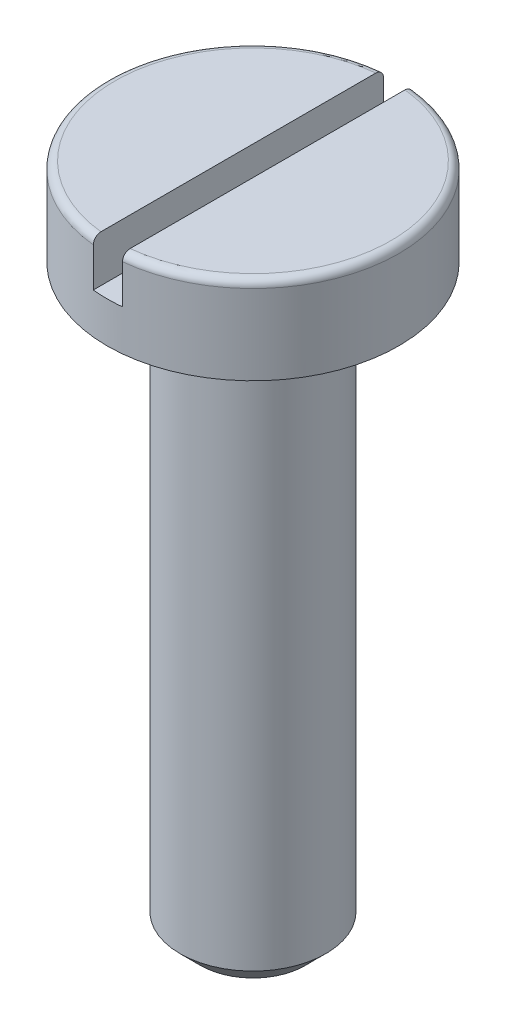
SolidWorks part; units mm, degrees
ref_plane "Face" through (0, 0, 0) normal (0, 0, 1) x (1, 0, 0)
ref_plane "Dessus" through (0, 0, 0) normal (0, 1, 0) x (1, 0, 0)
ref_plane "Droite" through (0, 0, 0) normal (1, 0, 0) x (0, 0, -1)
sketch "Esquisse1" plane through (0, 0, 0) normal (0, 1, 0) x (1, 0, 0)
  circle A0 centre (0, 0) radius 1.25
  dimension "Diamètre nominal" = 2.5
extrude "Base-Extrusion" add sketch "Esquisse1" against normal blind 10
chamfer "Chanfrein1" distance 0.35 angle 45 1 edges at (0, -10, 1.25)
sketch "Esquisse2" plane through (0, 0, 0) normal (0, 0, 1) x (1, 0, 0)
  line L0 (0, 1.5) -> (0, 0)
  line L2 (0, 0) -> (2.5, 0)
  line L4 (0, 1.5) -> (2.37, 1.5)
  line L5 (2.5, 0) -> (2.5, 1.37)
  line L7 (0, 1.3) -> (0, -10) construction
  line L8 (0, -9.65) -> (0, 0) construction
  line L9 (-0.9, -10) -> (0.9, -10) construction
  arc A0 (2.5, 1.37) -> (2.37, 1.5) centre (2.37, 1.37) ccw
  dimension "D2" = 0.13
  dimension "D1" = 5
  dimension "Hauteur tête" = 1.5
revolve "Boss.-Révol.1" add sketch "Esquisse2" angle 360 about L7
sketch "Esquisse3" plane through (0, 1.5, 0) normal (0, 1, 0) x (-1, 0, 0)
  line L0 (0, -2.5) -> (0, 2.5) construction
  line L1 (0.25, -2.5) -> (-0.25, -2.5)
  line L2 (0.25, 2.5) -> (-0.25, 2.5)
  line L3 (0.25, -2.5) -> (0.25, 2.5)
  line L4 (-0.25, -2.5) -> (-0.25, 2.5)
  circle A0 centre (0, 0) radius 2.5 construction
  dimension "Largeur fente" = 0.5
extrude "Enlèv. mat.-Extru.1" cut sketch "Esquisse3" against normal blind 0.8
